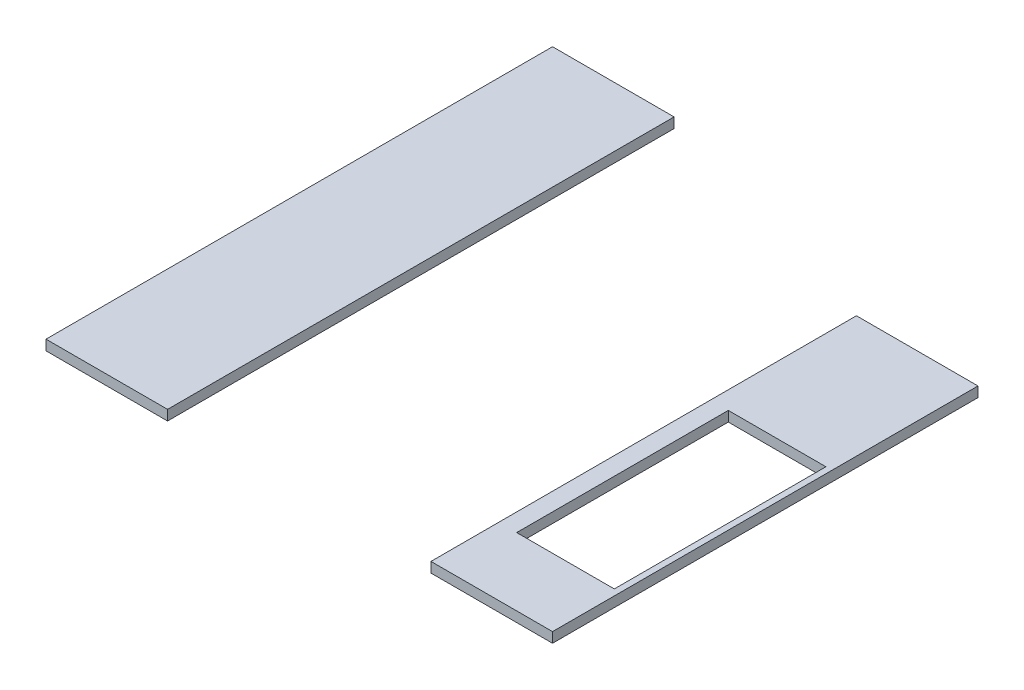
SolidWorks part; units mm, degrees
ref_plane "Plan de face" through (0, 0, 0) normal (0, 0, 1) x (1, 0, 0)
ref_plane "Plan de dessus" through (0, 0, 0) normal (0, 1, 0) x (1, 0, 0)
ref_plane "Plan de droite" through (0, 0, 0) normal (1, 0, 0) x (0, 0, -1)
sketch "Esquisse1" plane through (0, 0, 0) normal (0, 1, 0) x (1, 0, 0)
  line L1 (0, 0) -> (-600, 0)
  line L2 (0, 0) -> (0, 2100)
  line L3 (0, 2100) -> (-600, 2100)
  line L4 (-600, 0) -> (-600, 2100)
  line L5 (-1900, 0) -> (-2500, 0)
  line L6 (-1900, 0) -> (-1900, 2500)
  line L7 (-1900, 2500) -> (-2500, 2500)
  line L8 (-2500, 0) -> (-2500, 2500)
  dimension "D1" = 2500
  dimension "D2" = 2500
  dimension "D3" = 2100
  dimension "D4" = 600
  dimension "D5" = 600
extrude "Boss.-Extru.1" add sketch "Esquisse1" along normal blind 50
sketch "Esquisse2" plane through (0, 50, 0) normal (0, 1, 0) x (1, 0, 0)
  line L1 (-511.6682, 1379.2742) -> (-29.8781, 1379.2742)
  line L2 (-511.6682, 1379.2742) -> (-511.6682, 334.8274)
  line L3 (-511.6682, 334.8274) -> (-29.8781, 334.8274)
  line L4 (-29.8781, 1379.2742) -> (-29.8781, 334.8274)
extrude "Enlèv. mat.-Extru.1" cut sketch "Esquisse2" against normal blind 60
